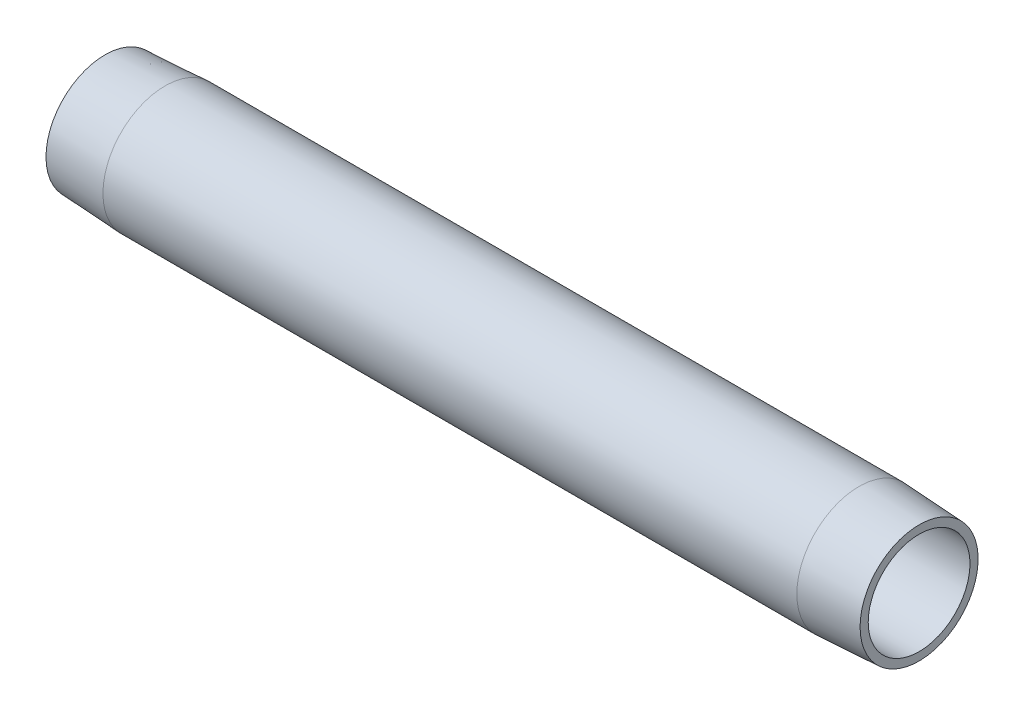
SolidWorks part; units mm, degrees
ref_plane "Front Plane" through (0, 0, 0) normal (0, 0, 1) x (1, 0, 0)
ref_plane "Top Plane" through (0, 0, 0) normal (0, 1, 0) x (1, 0, 0)
ref_plane "Right Plane" through (0, 0, 0) normal (1, 0, 0) x (0, 0, -1)
sketch "Sketch1" plane through (0, 0, 0) normal (0, 0, 1) x (1, 0, 0)
  line L6 (139.7, 8.7313) -> (0, 8.7313)
  line L7 (10.3124, 10.668) -> (0, 10.1276)
  line L8 (129.3876, 10.668) -> (10.3124, 10.668)
  line L9 (139.7, 10.1276) -> (129.3876, 10.668)
  line L10 (139.7, 8.7313) -> (139.7, 10.1276)
  line L11 (0, 10.1276) -> (0, 8.7313)
  line L12 (0, 0) -> (50000, 0) construction
  line L13 (0, -55) -> (0, 55) construction
  dimension "D1" = 139.7
  dimension "D2" = 3
  dimension "D3" = 3
  dimension "D4" = 21.336
  dimension "D5" = 17.4625
  dimension "D6" = 10.3124
  dimension "D7" = 10.3124
revolve "Revolve1" add sketch "Sketch1" angle 360 about L12
